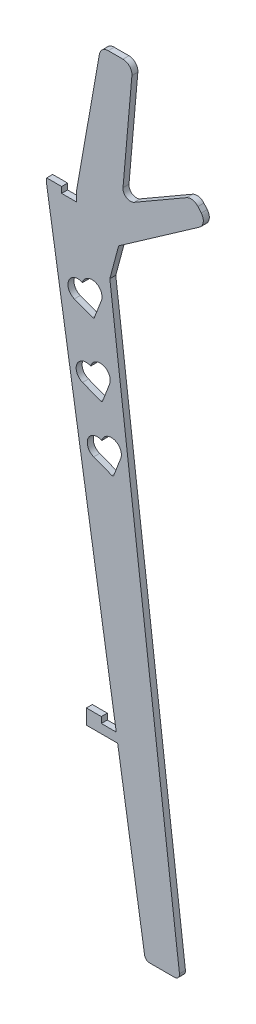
SolidWorks part; units mm, degrees
ref_plane "Alzado" through (0, 0, 0) normal (0, 0, 1) x (1, 0, 0)
ref_plane "Planta" through (0, 0, 0) normal (0, 1, 0) x (1, 0, 0)
ref_plane "Vista lateral" through (0, 0, 0) normal (1, 0, 0) x (0, 0, -1)
sketch "Sketch2" plane through (0, 0, 0) normal (0, 0, 1) x (1, 0, 0)
  line L4 (0, 0) -> (0, 1600) construction
  line L5 (0, 1600) -> (250, 1600) construction
  line L6 (250, 1600) -> (250, 0) construction
  line L7 (250, 0) -> (0, 0) construction
  line L8 (71.4815, 1215.9966) -> (53.7978, 1150)
  line L12 (-72.9806, 1250) -> (-72.9806, 1262)
  line L13 (-72.9806, 1262) -> (-42.9806, 1262)
  line L14 (-42.9806, 1262) -> (-42.9806, 1250)
  line L15 (-42.9806, 1250) -> (-12.9806, 1250)
  line L16 (-12.9806, 1250) -> (-12.9806, 1270)
  line L22 (233.9089, 1329.7296) -> (71.4815, 1215.9966)
  line L26 (32.8866, 1530.1257) -> (-12.9806, 1270)
  line L27 (98.1184, 1525.4312) -> (80.2884, 1321.6325)
  line L28 (207.8859, 1368.0459) -> (102.7313, 1307.3348)
  line L30 (69.5654, 350) -> (6.7145, 350)
  line L31 (6.7145, 350) -> (6.7145, 380)
  line L32 (6.7145, 380) -> (36.7145, 380)
  line L33 (36.7145, 380) -> (36.7145, 368)
  line L34 (36.7145, 368) -> (66.7145, 368)
  line L35 (-72.9806, 1250) -> (66.7145, 368)
  line L36 (133.5408, 0) -> (183.6971, 0)
  line L37 (53.7978, 1150) -> (193.6225, 11.2187)
  line L38 (69.5654, 350) -> (123.6639, 8.4357)
  line L39 (50.6132, 1545) -> (80.1869, 1545)
  line L40 (230.6747, 1364.0276) -> (237.3734, 1356.0445)
  arc A0 (80.2884, 1321.6325) -> (102.7313, 1307.3348) centre (95.2313, 1320.3252) ccw
  arc A9 (193.6225, 11.2187) -> (183.6971, 0) centre (183.6971, 10) cw
  arc A10 (133.5408, 0) -> (123.6639, 8.4357) centre (133.5408, 10) cw
  arc A11 (98.1184, 1525.4312) -> (80.1869, 1545) centre (80.1869, 1527) ccw
  arc A12 (50.6132, 1545) -> (32.8866, 1530.1257) centre (50.6132, 1527) ccw
  arc A13 (233.9089, 1329.7296) -> (237.3734, 1356.0445) centre (223.5846, 1344.4743) ccw
  arc A14 (230.6747, 1364.0276) -> (207.8859, 1368.0459) centre (216.8859, 1352.4574) ccw
  point P26 (195, 0)
  point P29 (125, 0)
  point P33 (250, 1340.9966)
  point P34 (250, 1340.9966)
  point P36 (221.0746, 1375.4686)
  point P39 (35.5094, 1545)
  point P48 (71.4815, 1215.9966)
  dimension "D21" = 15
  dimension "D22" = 10
  dimension "D24" = 275
  dimension "D14" = 18
  dimension "D30" = 18
  dimension "D1" = 1600
  dimension "D2" = 250
  dimension "D3" = 9
  dimension "D4" = 70
  dimension "D5" = 30
  dimension "D6" = 2
  dimension "D7" = 75
  dimension "D8" = 125
  dimension "D9" = 30
  dimension "D10" = 100
  dimension "D11" = 12
  dimension "D12" = 1250
  dimension "D13" = 45
  dimension "D15" = 5
  dimension "D16" = 100
  dimension "D17" = 1150
  dimension "D18" = 5
  dimension "D19" = 55
  dimension "D20" = 100
  dimension "D23" = 20
  dimension "D25" = 30
  dimension "D26" = 30
  dimension "D27" = 12
  dimension "D28" = 350
  dimension "D29" = 30
extrude "Boss-Extrude2" add sketch "Sketch2" along normal blind 12
sketch "Sketch3" plane through (0, 0, 12) normal (0, 0, 1) x (1, 0, 0)
  line L0 (-17.4955, 1079.2108) -> (18.9141, 1065.2344)
  line L1 (22.79, 1066.9601) -> (36.7663, 1103.3697)
  line L2 (-72.9806, 1250) -> (66.7145, 368) construction
  line L3 (-1.2293, 1115.6928) -> (27.6502, 1050.8284) construction
  line L4 (-0.984, 942.2336) -> (35.4257, 928.2573)
  line L5 (39.3015, 929.9829) -> (53.2778, 966.3926)
  line L6 (15.2822, 978.7157) -> (44.1617, 913.8512) construction
  line L8 (21.3426, 823.9867) -> (57.7522, 810.0104)
  line L9 (61.6281, 811.736) -> (75.6044, 848.1456)
  line L10 (37.6088, 860.4687) -> (66.4883, 795.6043) construction
  arc A0 (-1.2293, 1115.6928) -> (-17.4955, 1079.2108) centre (-10.3282, 1097.8824) ccw
  arc A1 (36.7663, 1103.3697) -> (-1.2293, 1115.6928) centre (18.0947, 1110.5371) ccw
  arc A2 (22.79, 1066.9601) -> (18.9141, 1065.2344) centre (19.9892, 1068.0352) cw
  arc A3 (15.2822, 978.7157) -> (-0.984, 942.2336) centre (6.1834, 960.9052) ccw
  arc A4 (53.2778, 966.3926) -> (15.2822, 978.7157) centre (34.6062, 973.5599) ccw
  arc A5 (39.3015, 929.9829) -> (35.4257, 928.2573) centre (36.5008, 931.058) cw
  arc A6 (37.6088, 860.4687) -> (21.3426, 823.9867) centre (28.5099, 842.6583) ccw
  arc A7 (75.6044, 848.1456) -> (37.6088, 860.4687) centre (56.9328, 855.313) ccw
  arc A8 (61.6281, 811.736) -> (57.7522, 810.0104) centre (58.8273, 812.8111) cw
  point P2 (0, 0)
  point P8 (-6.8121, 1151.9236)
  point P13 (21.7149, 1064.1593)
  dimension "D2" = 40
  dimension "D3" = 40
  dimension "D6" = 3
  dimension "D7" = 40
  dimension "D8" = 40
  dimension "D10" = 3
  dimension "D1" = 60
  dimension "D4" = 45
  dimension "D5" = 42
  dimension "D9" = 45
extrude "Cut-Extrude1" cut sketch "Sketch3" against normal up to surface (12 mm away)
